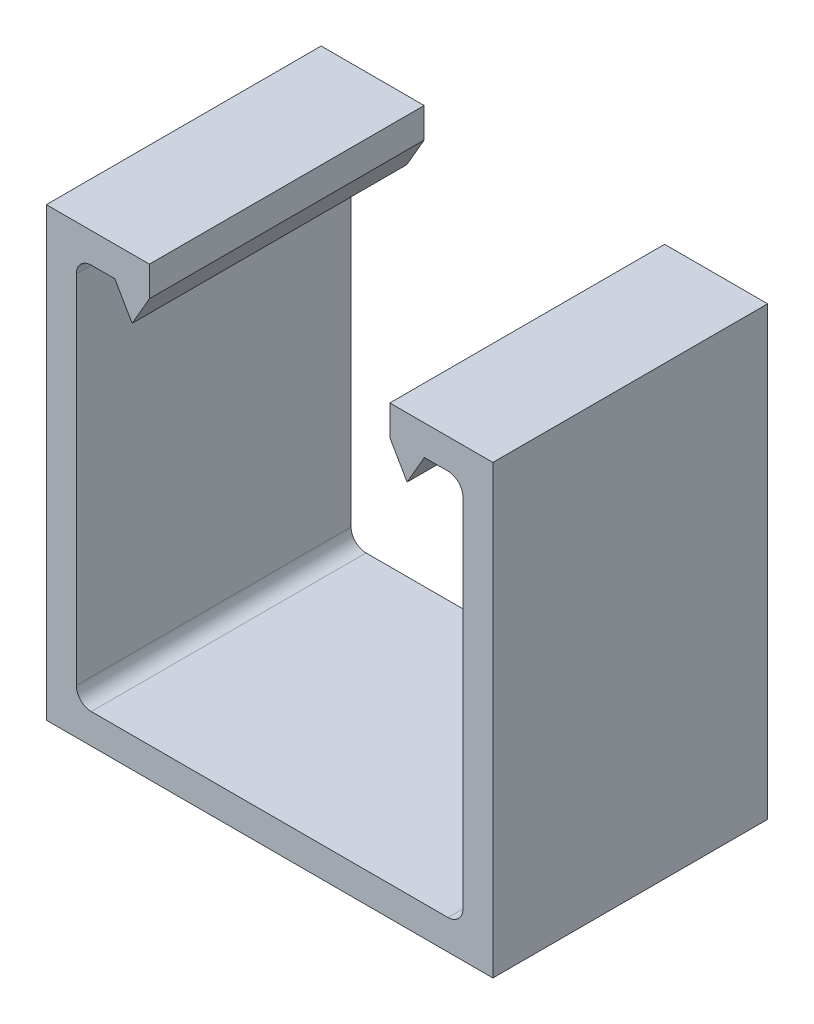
SolidWorks part; units mm, degrees
ref_plane "Plane1" through (0, 0, 0) normal (0, 0, 1) x (1, 0, 0)
ref_plane "Plane2" through (0, 0, 0) normal (0, 1, 0) x (1, 0, 0)
ref_plane "Plane3" through (0, 0, 0) normal (1, 0, 0) x (0, 0, -1)
sketch "Sketch1" plane through (0, 0, 0) normal (0, 0, 1) x (1, 0, 0)
  line L0 (-11.1125, 20.6375) -> (-20.6375, 20.6375)
  line L1 (-20.6375, 20.6375) -> (-20.6375, -20.6375)
  line L2 (-20.6375, -20.6375) -> (20.6375, -20.6375)
  line L3 (20.6375, -20.6375) -> (20.6375, 20.6375)
  line L4 (20.6375, 20.6375) -> (11.1125, 20.6375)
  line L5 (16.4846, 17.8689) -> (14.3094, 17.8689)
  line L6 (17.8689, -16.4846) -> (17.8689, 16.4846)
  line L7 (-16.4846, -17.8689) -> (16.4846, -17.8689)
  line L8 (-17.8689, 16.4846) -> (-17.8689, -16.4846)
  line L9 (-14.3094, 17.8689) -> (-16.4846, 17.8689)
  line L10 (14.3094, 17.8689) -> (12.711, 15.1003)
  line L11 (12.711, 15.1003) -> (11.1125, 17.8689)
  line L12 (11.1125, 17.8689) -> (11.1125, 20.6375)
  line L13 (-14.3094, 17.8689) -> (-12.711, 15.1003)
  line L14 (-12.711, 15.1003) -> (-11.1125, 17.8689)
  line L15 (-11.1125, 17.8689) -> (-11.1125, 20.6375)
  arc A0 (-17.8689, -16.4846) -> (-16.4846, -17.8689) centre (-16.4846, -16.4846) ccw
  arc A1 (-16.4846, 17.8689) -> (-17.8689, 16.4846) centre (-16.4846, 16.4846) ccw
  arc A2 (17.8689, 16.4846) -> (16.4846, 17.8689) centre (16.4846, 16.4846) ccw
  arc A3 (16.4846, -17.8689) -> (17.8689, -16.4846) centre (16.4846, -16.4846) ccw
  dimension "D5" = 1.3843
  dimension "D4" = 60
  dimension "Width" = 41.275
  dimension "Height" = 41.275
  dimension "D8" = 20.6375
  dimension "D9" = 20.6375
  dimension "D10" = 22.225
  dimension "edge" = 9.525
  dimension "D13" = 1.5985
extrude "Base-Extrude" add sketch "Sketch1" along normal mid plane 25.4
equation "\"D8@Sketch1\" = \"Width@Sketch1\" / 2"
equation "\"D9@Sketch1\" = \"Height@Sketch1\" / 2"
equation "\"D10@Sketch1\" = \"Width@Sketch1\" - 2 * \"edge@Sketch1\""
equation "\"D5@Sketch1\" = \"gauge@Sketch1\" / 2"
equation "\"D13@Sketch1\" = \"gauge@Sketch1\" * .577350269"
